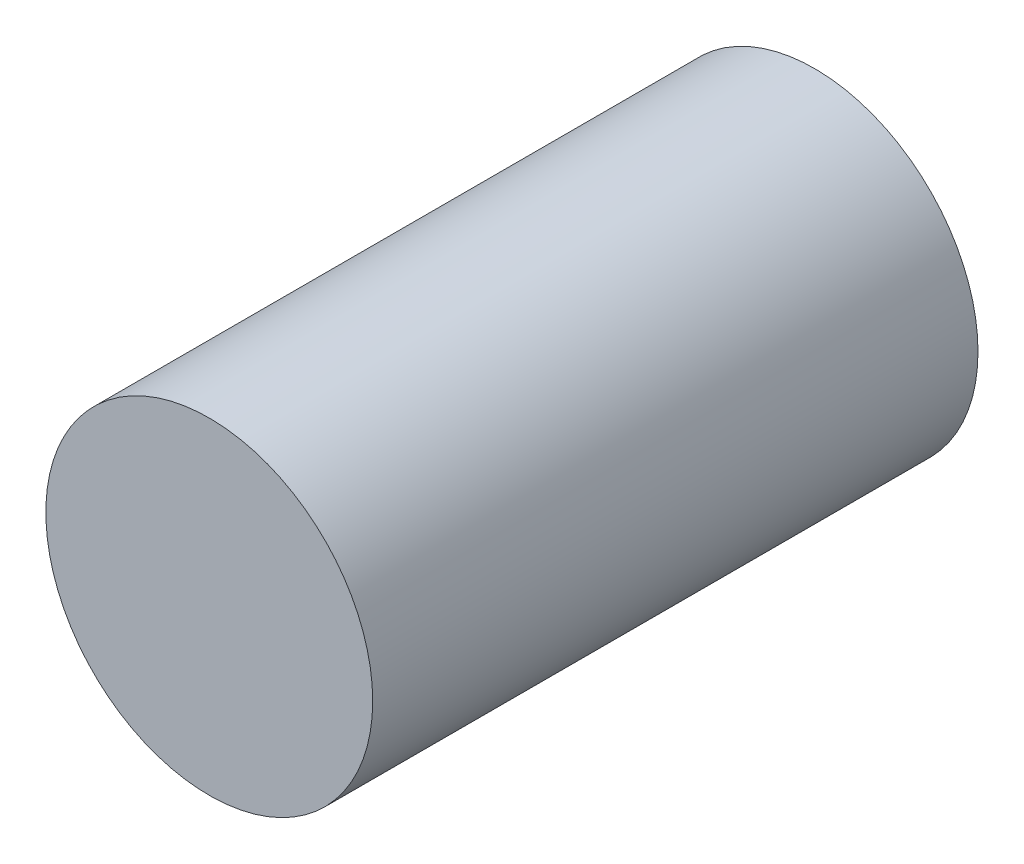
SolidWorks part; units mm, degrees
ref_plane "Piano frontale" through (0, 0, 0) normal (0, 0, 1) x (1, 0, 0)
ref_plane "Piano superiore" through (0, 0, 0) normal (0, 1, 0) x (1, 0, 0)
ref_plane "Piano destro" through (0, 0, 0) normal (1, 0, 0) x (0, 0, -1)
sketch "Schizzo1" plane through (0, 0, 0) normal (0, 0, 1) x (1, 0, 0)
  circle A0 centre (0, 0) radius 13.5
  dimension "D1" = 27
extrude "Estrusione-Estrusione1" add sketch "Schizzo1" along normal blind 50
